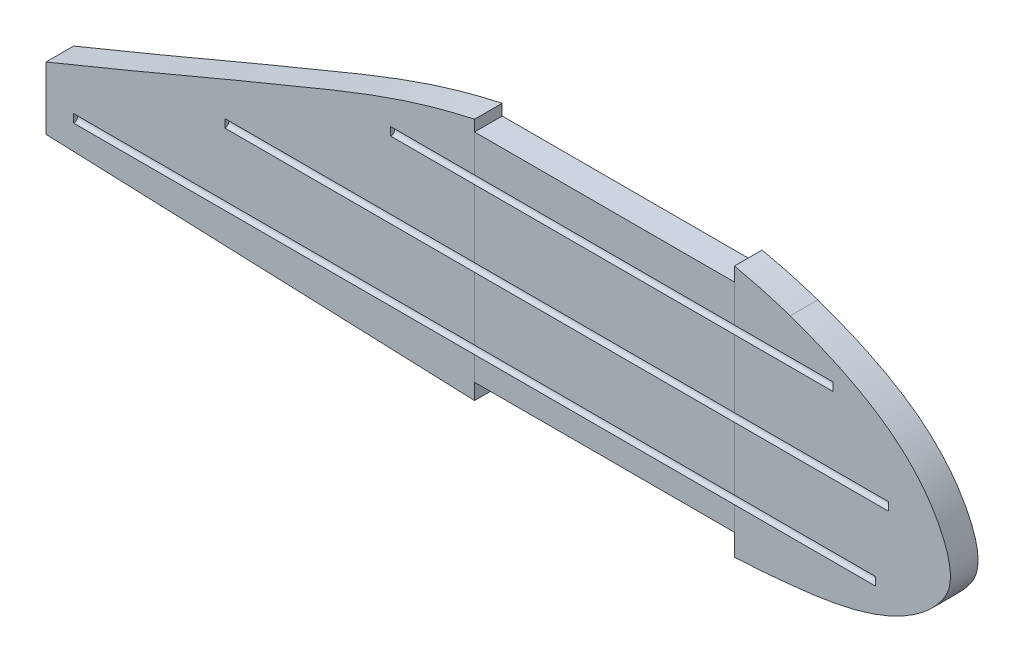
SolidWorks part; units mm, degrees
ref_plane "Front Plane" through (0, 0, 0) normal (0, 0, 1) x (1, 0, 0)
ref_plane "Top Plane" through (0, 0, 0) normal (0, 1, 0) x (1, 0, 0)
ref_plane "Right Plane" through (0, 0, 0) normal (1, 0, 0) x (0, 0, -1)
sketch "Sketch1" plane through (0, 0, 0) normal (0, 0, 1) x (1, 0, 0)
  line L1 (43.9494, -44.1146) -> (57.3058, -44.0649)
  line L4 (-174.6614, -29.5786) -> (-22.2614, -29.5786) construction
  line L5 (-174.6614, -35.7968) -> (43.9494, -44.1146)
  line L6 (-174.6614, -35.7968) -> (-174.6614, -13.1322)
  line L7 (-22.2614, -29.5786) -> (-22.2614, 38.4969)
  line L8 (-22.2614, -29.5786) -> (-22.2614, -41.5954)
  line L9 (-22.2614, 38.4969) -> (-22.2614, 45.8569)
  line L10 (-22.2614, -8.7616) -> (-85.7614, -8.7616) construction
  spline S0 degree 3 poles (94.5033, 41.9457) (112.7923, 35.3966) (135.0858, 24.8841) (149.3763, 2.3867) (152.7436, -7.7565) (152.3159, -15.166) (147.6884, -22.7221) (133.9275, -34.5208) (112.3571, -40.4525) (91.2592, -42.5691) (74.7609, -43.9718) (63.8436, -43.9441) (57.3058, -44.0649) knots 0.590928 0.590928 0.590928 0.590928 0.703711 0.737074 0.756629 0.770482 0.782246 0.811517 0.882897 0.918428 0.946042 0.987359 0.987359 0.987359 0.987359
  spline S1 degree 3 poles (-174.6614, -13.1322) (-142.1631, 0.006) (-98.8205, 18.9008) (-48.1018, 39.1227) (-18.558, 47.174) (27.523, 54.6535) (67.5235, 50.9967) (94.5033, 41.9457) knots 0 0 0 0 0.372977 0.50422 0.580661 0.698669 1 1 1 1
  dimension "D1" = 327.007
  dimension "D2" = 152.4
  dimension "D3" = 7.36
  dimension "D4" = 63.5
extrude "Boss-Extrude1" add sketch "Sketch1" along normal blind 10 contours S1 L6 L5 L8 L7 L9 | S1 L9 L7 L8 L5 L1 S0
sketch "Sketch2" plane through (0, 0, 10) normal (0, 0, 1) x (1, 0, 0)
  line L0 (74.3386, -35.9443) -> (74.3386, -43.7469)
  line L1 (-19.6614, -35.9443) -> (-19.6614, -41.6943)
  line L2 (-19.6614, -35.9443) -> (74.3386, -35.9443)
  line L3 (-174.6614, -13.1322) -> (-174.6614, -35.7968)
  line L4 (-174.6614, -35.7968) -> (43.9494, -44.1146)
  line L5 (43.9494, -44.1146) -> (57.3058, -44.0649)
  line L6 (-174.6614, -13.1322) -> (-174.6614, -35.7968) construction
  line L7 (-19.6614, -41.6943) -> (43.9494, -44.1146)
  line L8 (43.9494, -44.1146) -> (57.3058, -44.0649)
  line L9 (-19.6614, 46.4371) -> (-19.6614, 42.4371)
  line L10 (-19.6614, 42.4371) -> (74.3386, 42.4371)
  line L11 (74.3386, 42.4371) -> (74.3386, 47.4711)
  spline S0 degree 3 poles (-1801.7363, 1035.3086) (-696.3473, -316.5614) (-396.6248, -99.836) (-48.1018, 39.1227) (-18.558, 47.174) (238.0988, 88.8327) (529.6457, -279.917) (-570.613, -1790.4795) knots -3.409459 -3.409459 -3.409459 -3.409459 0.372977 0.50422 0.580661 0.698669 3.265562 3.265562 3.265562 3.265562 only from (-174.6614, -13.1322) to (94.5033, 41.9457) construction
  spline S1 degree 3 poles (-19.6614, 46.4371) (-9.6956, 48.6073) (21.5415, 53.4943) (53.4359, 51.9765) (74.3386, 47.4711) knots 0.590112 0.590112 0.590112 0.590112 0.698669 0.92599 0.92599 0.92599 0.92599
  spline S2 degree 3 poles (-28.0686, -950.5099) (408.3759, -142.4186) (185.3963, 80.2784) (-18.558, 47.174) (-48.1018, 39.1227) (-315.8137, -67.616) (-552.2868, -218.5899) (-1124.5027, 299.5997) knots -1.698541 -1.698541 -1.698541 -1.698541 0.301331 0.419339 0.49578 0.627023 3.48428 3.48428 3.48428 3.48428 only from (94.5033, 41.9457) to (-174.6614, -13.1322)
  spline S3 degree 3 poles (-191.5383, -3021.6226) (-176.3859, 68.6204) (-43.2227, -54.0028) (91.2592, -42.5691) (112.3571, -40.4525) (133.9275, -34.5208) (147.6884, -22.7221) (152.3159, -15.166) (152.7436, -7.7565) (149.3763, 2.3867) (53.7874, 152.871) (-577.9359, -217.1554) (2144.6649, 2209.8537) knots -0.156107 -0.156107 -0.156107 -0.156107 0.632244 0.659859 0.69539 0.766769 0.796041 0.807805 0.821657 0.841213 0.874576 1.930031 1.930031 1.930031 1.930031 only from (57.3058, -44.0649) to (94.5033, 41.9457)
  spline S5 degree 3 poles (57.3058, -44.0649) (62.9826, -43.96) (68.6639, -43.9587) (74.3386, -43.7469) knots 0.590928 0.590928 0.590928 0.590928 0.626803 0.626803 0.626803 0.626803
  dimension "D2" = 155
  dimension "D3" = 94
  dimension "D4" = 5.75
  dimension "D5" = 4
  dimension "D6" = 94
  dimension "D1" = 0
extrude "Cut-Extrude1" cut sketch "Sketch2" against normal through all
sketch "Sketch3" plane through (0, 0, 10) normal (0, 0, 1) x (1, 0, 0)
  line L0 (-19.6614, 46.4371) -> (-19.6614, -41.6943)
  line L1 (74.3386, 47.4711) -> (74.3386, -43.7469)
  line L18 (74.3386, 47.4711) -> (74.3386, 42.4371)
  line L19 (74.3386, 42.4371) -> (-19.6614, 42.4371)
  line L20 (-19.6614, 42.4371) -> (-19.6614, 46.4371)
  line L21 (-174.6614, -13.1322) -> (-174.6614, -35.7968)
  line L22 (-174.6614, -35.7968) -> (-19.6614, -41.6943)
  line L23 (-19.6614, -41.6943) -> (-19.6614, -35.9443)
  line L24 (-19.6614, -35.9443) -> (74.3386, -35.9443)
  line L25 (74.3386, -35.9443) -> (74.3386, -43.7469)
  line L26 (74.3386, 47.4711) -> (74.3386, 42.4371)
  line L28 (-19.6614, 42.4371) -> (-19.6614, 46.4371)
  line L29 (-174.6614, -13.1322) -> (-174.6614, -35.7968)
  line L30 (-174.6614, -35.7968) -> (-19.6614, -41.6943)
  line L31 (-19.6614, -41.6943) -> (-19.6614, -35.9443)
  line L33 (74.3386, -35.9443) -> (74.3386, -43.7469)
  spline S6 degree 3 poles (-213.646, -2842.754) (639.4154, -283.2826) (245.9816, 119.2668) (-48.1018, 39.1227) (-450.4905, -121.3126) (-789.7576, -386.8584) (-2411.1612, 1828.1387) knots -3.024854 -3.024854 -3.024854 -3.024854 0.009451 0.085893 0.217135 4.61626 4.61626 4.61626 4.61626 only from (-19.6614, 46.4371) to (-174.6614, -13.1322)
  spline S7 degree 3 poles (-191.5177, -3017.4324) (-176.2696, 68.5133) (-43.1664, -53.998) (91.2592, -42.5691) (112.3571, -40.4525) (133.9275, -34.5208) (147.6884, -22.7221) (152.3159, -15.166) (152.7436, -7.7565) (149.3763, 2.3867) (53.787, 152.8717) (-577.9423, -217.1591) (2144.7071, 2209.8913) knots -0.191626 -0.191626 -0.191626 -0.191626 0.596369 0.623983 0.659514 0.730894 0.760165 0.771929 0.785782 0.805337 0.8387 1.894161 1.894161 1.894161 1.894161 only from (74.3386, -43.7469) to (94.5033, 41.9457)
  spline S8 degree 3 poles (-1186.2231, -2578.4534) (2775.232, 2211.8546) (-3553.5237, -1234.0974) (2978.0418, -111.7589) knots -1.737068 -1.737068 -1.737068 -1.737068 4.775713 4.775713 4.775713 4.775713 only from (94.5033, 41.9457) to (74.3386, 47.4711)
  spline S9 degree 3 poles (-19.6614, 46.4371) (-20.5291, 46.2482) (-28.4053, 44.4904) (-48.1018, 39.1227) (-98.8205, 18.9008) (-142.1631, 0.006) (-174.6614, -13.1322) knots 0 0 0 0 0.009451 0.085893 0.217135 0.590112 0.590112 0.590112 0.590112
  spline S10 degree 3 poles (74.3386, -43.7469) (75.1992, -43.7147) (80.4269, -43.4901) (91.2592, -42.5691) (112.3571, -40.4525) (133.9275, -34.5208) (147.6884, -22.7221) (152.3159, -15.166) (152.7436, -7.7565) (149.3763, 2.3867) (135.0858, 24.8841) (112.7923, 35.3966) (94.5033, 41.9457) knots 0.590928 0.590928 0.590928 0.590928 0.596369 0.623983 0.659514 0.730894 0.760165 0.771929 0.785782 0.805337 0.8387 0.951484 0.951484 0.951484 0.951484
  spline S11 degree 3 poles (94.5033, 41.9457) (87.8768, 44.1687) (81.1439, 46.0042) (74.3386, 47.4711) knots 0.92599 0.92599 0.92599 0.92599 1 1 1 1
  dimension "D1" = 0
sketch "Sketch5" plane through (-174.6614, 0, 0) normal (-1, 0, 0) x (0, 0, 1)
  line L1 (0, -35.7968) -> (0, -13.1322) construction
  line L2 (10, -35.7968) -> (0, -35.7968) construction
  circle A0 centre (0, -25.7968) radius 1.5
  dimension "D1" = 3
  dimension "D2" = 10
extrude "Cut-Extrude2" cut sketch "Sketch5" against normal blind 290 from offset 10
sketch "Sketch6" plane through (0, 0, 0) normal (1, 0, 0) x (0, 0, -1)
  line L1 (0, 47.4711) -> (-10, 47.4711) construction
  line L2 (0, -43.7469) -> (0, 41.9457) construction
  circle A0 centre (0, 0) radius 1.5
  dimension "D1" = 3
  dimension "D2" = 47.4711
extrude "Cut-Extrude3" cut sketch "Sketch6" against normal blind 110 and the other way blind 130
sketch "Sketch7" plane through (0, 0, 0) normal (1, 0, 0) x (0, 0, -1)
  line L1 (0, 47.4711) -> (-10, 47.4711) construction
  line L2 (0, -43.7469) -> (0, 41.9457) construction
  circle A0 centre (0, 27.4711) radius 1.5
  dimension "D1" = 3
  dimension "D2" = 20
extrude "Cut-Extrude4" cut sketch "Sketch7" against normal blind 50 and the other way blind 110
sketch "Sketch8" plane through (0, 0, 0) normal (0, 0, -1) x (-1, 0, 0)
  line L0 (-112.4386, 34.6419) -> (-112.4386, -39.663)
  line L1 (-74.3386, -35.9443) -> (-74.3386, -27.2968) construction
  line L5 (-74.3386, -43.7469) -> (-74.3386, -35.9443)
  line L6 (-74.3386, -35.9443) -> (-74.3386, -27.2968)
  line L7 (-74.3386, 42.4371) -> (-74.3386, 47.4711)
  line L8 (-74.3386, -43.7469) -> (-74.3386, -35.9443)
  line L9 (-74.3386, -35.9443) -> (-74.3386, -27.2968)
  line L10 (-74.3386, 42.4371) -> (-74.3386, 47.4711)
  line L15 (-125.3386, -27.2968) -> (-125.3386, -24.2968)
  line L19 (-130, 1.5) -> (-74.3386, 1.5)
  line L27 (-130, 1.5) -> (-74.3386, 1.5)
  line L28 (-110, 28.9711) -> (-74.3386, 28.9711)
  line L32 (-74.3386, -1.5) -> (-130, -1.5)
  line L33 (-74.3386, -1.5) -> (-130, -1.5)
  line L34 (-130, -1.5) -> (-130, 1.5)
  line L35 (-130, -1.5) -> (-130, 1.5)
  line L38 (-125.3386, -27.2968) -> (-125.3386, -24.2968)
  line L39 (-125.3386, -24.2968) -> (-74.3386, -24.2968)
  line L40 (-110, 28.9711) -> (-74.3386, 28.9711)
  line L41 (-125.3386, -24.2968) -> (-74.3386, -24.2968)
  line L43 (-74.3386, 1.5) -> (-74.3386, 25.9711)
  line L44 (-74.3386, 1.5) -> (-74.3386, 25.9711)
  line L45 (-74.3386, 25.9711) -> (-110, 25.9711)
  line L46 (-74.3386, 25.9711) -> (-110, 25.9711)
  line L47 (-110, 25.9711) -> (-110, 28.9711)
  line L48 (-110, 25.9711) -> (-110, 28.9711)
  line L49 (-74.3386, -27.2968) -> (-125.3386, -27.2968)
  line L50 (-74.3386, -27.2968) -> (-125.3386, -27.2968)
  line L51 (-74.3386, -24.2968) -> (-74.3386, -1.5)
  line L52 (-74.3386, -24.2968) -> (-74.3386, -1.5)
  line L53 (-74.3386, 28.9711) -> (-74.3386, 42.4371)
  line L54 (-74.3386, 28.9711) -> (-74.3386, 42.4371)
  spline S0 degree 3 poles (-94.5033, 41.9457) (-112.7923, 35.3966) (-135.0858, 24.8841) (-149.3763, 2.3867) (-152.7436, -7.7565) (-152.3159, -15.166) (-147.6884, -22.7221) (-133.9275, -34.5208) (-112.3571, -40.4525) (-91.2592, -42.5691) (-80.4269, -43.4901) (-75.1992, -43.7147) (-74.3386, -43.7469) knots 0.590928 0.590928 0.590928 0.590928 0.703711 0.737074 0.756629 0.770482 0.782246 0.811517 0.882897 0.918428 0.946042 0.951484 0.951484 0.951484 0.951484 construction
  spline S3 degree 3 poles (-2977.9657, -111.772) (3553.4547, -1234.0672) (-2775.1782, 2211.8151) (1186.187, -2578.4098) knots -2.849697 -2.849697 -2.849697 -2.849697 3.663038 3.663038 3.663038 3.663038 only from (-74.3386, 47.4711) to (-94.5033, 41.9457)
  spline S4 degree 3 poles (-2144.673, 2209.8609) (577.9372, -217.1561) (-53.7873, 152.8711) (-149.3763, 2.3867) (-152.7436, -7.7565) (-152.3159, -15.166) (-147.6884, -22.7221) (-133.9275, -34.5208) (-112.3571, -40.4525) (-91.2592, -42.5691) (43.1674, -53.9981) (176.2717, 68.5153) (191.518, -3017.5113) knots -0.351745 -0.351745 -0.351745 -0.351745 0.703711 0.737074 0.756629 0.770482 0.782246 0.811517 0.882897 0.918428 0.946042 1.734043 1.734043 1.734043 1.734043 only from (-94.5033, 41.9457) to (-74.3386, -43.7469)
  spline S5 degree 3 poles (-74.3386, 47.4711) (-81.1439, 46.0042) (-87.8768, 44.1687) (-94.5033, 41.9457) knots 0.92599 0.92599 0.92599 0.92599 1 1 1 1
  spline S6 degree 3 poles (-94.5033, 41.9457) (-112.7923, 35.3966) (-135.0858, 24.8841) (-149.3763, 2.3867) (-152.7436, -7.7565) (-152.3159, -15.166) (-147.6884, -22.7221) (-133.9275, -34.5208) (-112.3571, -40.4525) (-91.2592, -42.5691) (-80.4269, -43.4901) (-75.1992, -43.7147) (-74.3386, -43.7469) knots 0.590928 0.590928 0.590928 0.590928 0.703711 0.737074 0.756629 0.770482 0.782246 0.811517 0.882897 0.918428 0.946042 0.951484 0.951484 0.951484 0.951484
  dimension "D1" = 38.1
  dimension "D2" = 0
ref_plane "Plane1" through (0, 0, 5) normal (0, 0, -1) x (-1, 0, 0)
mirror "Mirror1" about plane through (0, 0, 5) normal (0, 0, -1) of "Cut-Extrude2", "Cut-Extrude4", "Cut-Extrude3"
sketch "Sketch9" plane through (110, 0, 0) normal (-1, 0, 0) x (0, 0, 1)
  line L1 (0, 28.9711) -> (0, 25.9711)
  line L2 (0, 28.9711) -> (0, 25.9711)
  arc A1 (0, 25.9711) -> (0, 28.9711) centre (0, 27.4711) ccw
  arc A2 (0, 25.9711) -> (0, 28.9711) centre (0, 27.4711) ccw
  dimension "D1" = 0
extrude "Boss-Extrude2" add sketch "Sketch9" along normal up to surface (160 mm away)
sketch "Sketch10" plane through (130, 0, 0) normal (-1, 0, 0) x (0, 0, 1)
  line L1 (0, 1.5) -> (0, -1.5)
  line L2 (0, 1.5) -> (0, -1.5)
  arc A1 (0, -1.5) -> (0, 1.5) centre (0, 0) ccw
  arc A2 (0, -1.5) -> (0, 1.5) centre (0, 0) ccw
  dimension "D1" = 0
extrude "Boss-Extrude3" add sketch "Sketch10" along normal up to surface (240 mm away)
sketch "Sketch11" plane through (125.3386, 0, 0) normal (-1, 0, 0) x (0, 0, 1)
  line L1 (0, -24.2968) -> (0, -27.2968)
  line L2 (0, -24.2968) -> (0, -27.2968)
  arc A1 (0, -27.2968) -> (0, -24.2968) centre (0, -25.7968) ccw
  arc A2 (0, -27.2968) -> (0, -24.2968) centre (0, -25.7968) ccw
  dimension "D1" = 0
extrude "Boss-Extrude4" add sketch "Sketch11" along normal up to surface (290 mm away)
sketch "Sketch12" plane through (0, 0, 0) normal (0, 0, -1) x (-1, 0, 0)
  line L0 (-74.3386, 47.4711) -> (-74.3386, -43.7469)
  line L1 (19.6614, 46.4371) -> (19.6614, -41.6943)
  line L42 (174.6614, -35.7968) -> (19.6614, -41.6943) construction
  line L43 (174.6614, -35.7968) -> (174.6614, -13.1322) construction
  line L44 (174.6614, -35.7968) -> (19.6614, -41.6943)
  line L45 (174.6614, -35.7968) -> (174.6614, -13.1322)
  line L46 (-112.4386, 34.6419) -> (-112.4386, -39.663)
  spline S1 degree 3 poles (-1989.1594, -260.6516) (2556.2417, -831.2335) (-1892.7002, 1591.4784) (570.5765, -1790.4294) knots -2.481427 -2.481427 -2.481427 -2.481427 3.265533 3.265533 3.265533 3.265533 only from (-74.3386, 47.4711) to (-94.5033, 41.9457) construction
  spline S2 degree 3 poles (-1401.1713, 1541.2139) (1728.0338, -1304.4061) (-1838.459, 1427.6499) (1119.6252, -1527.458) knots -0.242327 -0.242327 -0.242327 -0.242327 1.351337 1.351337 1.351337 1.351337 only from (-94.5033, 41.9457) to (-112.4386, 34.6419) construction
  spline S3 degree 3 poles (-1404.3166, 1544.074) (456.9681, -148.3279) (-63.1778, 138.0879) (-149.3763, 2.3867) (-152.7436, -7.7565) (-152.3159, -15.166) (-147.6884, -22.7221) (-48.2505, -107.9806) (278.8568, 198.9544) (-1585.0526, -1390.7948) knots -0.242861 -0.242861 -0.242861 -0.242861 0.703711 0.737074 0.756629 0.770482 0.782246 0.811517 1.582804 1.582804 1.582804 1.582804 only from (-112.4386, 34.6419) to (-112.4386, -39.663) construction
  spline S4 degree 3 poles (959.622, 1635.6946) (-315.2664, 99.1801) (-202.0647, -31.4526) (-91.2592, -42.5691) (27.8532, -52.6961) (144.684, 41.2715) (180.9594, -2017.6455) knots 0.239522 0.239522 0.239522 0.239522 0.882897 0.918428 0.946042 1.637078 1.637078 1.637078 1.637078 only from (-112.4386, -39.663) to (-74.3386, -43.7469) construction
  spline S10 degree 3 poles (-112.4386, -39.663) (-110.5475, -40.0482) (-103.0522, -41.386) (-91.2592, -42.5691) (-80.4269, -43.4901) (-75.1992, -43.7147) (-74.3386, -43.7469) knots 0.870848 0.870848 0.870848 0.870848 0.882897 0.918428 0.946042 0.951484 0.951484 0.951484 0.951484
  spline S11 degree 3 poles (-112.4386, 34.6419) (-123.729, 29.3) (-138.3626, 19.7256) (-149.3763, 2.3867) (-152.7436, -7.7565) (-152.3159, -15.166) (-147.6884, -22.7221) (-135.4025, -33.2561) (-121.7502, -37.7666) (-112.4386, -39.663) knots 0.628922 0.628922 0.628922 0.628922 0.703711 0.737074 0.756629 0.770482 0.782246 0.811517 0.870848 0.870848 0.870848 0.870848
  spline S12 degree 3 poles (-74.3386, 47.4711) (-81.1439, 46.0042) (-87.8768, 44.1687) (-94.5033, 41.9457) knots 0.92599 0.92599 0.92599 0.92599 1 1 1 1
  spline S13 degree 3 poles (-94.5033, 41.9457) (-100.6645, 39.7394) (-106.7027, 37.3557) (-112.4386, 34.6419) knots 0.590928 0.590928 0.590928 0.590928 0.628922 0.628922 0.628922 0.628922
  spline S14 degree 3 poles (1801.7391, 1035.3121) (696.3478, -316.5618) (396.6251, -99.8361) (48.1018, 39.1227) (-207.2355, 108.7077) (-533.4676, -181.7735) (-76.8282, -1885.9056) knots -3.409462 -3.409462 -3.409462 -3.409462 0.372977 0.50422 0.580661 3.187827 3.187827 3.187827 3.187827 only from (174.6614, -13.1322) to (19.6614, 46.4371) construction
  spline S15 degree 3 poles (174.6614, -13.1322) (142.1631, 0.006) (98.8205, 18.9008) (48.1018, 39.1227) (28.4053, 44.4904) (20.5291, 46.2482) (19.6614, 46.4371) knots 0 0 0 0 0.372977 0.50422 0.580661 0.590112 0.590112 0.590112 0.590112
  dimension "D1" = 38.1
